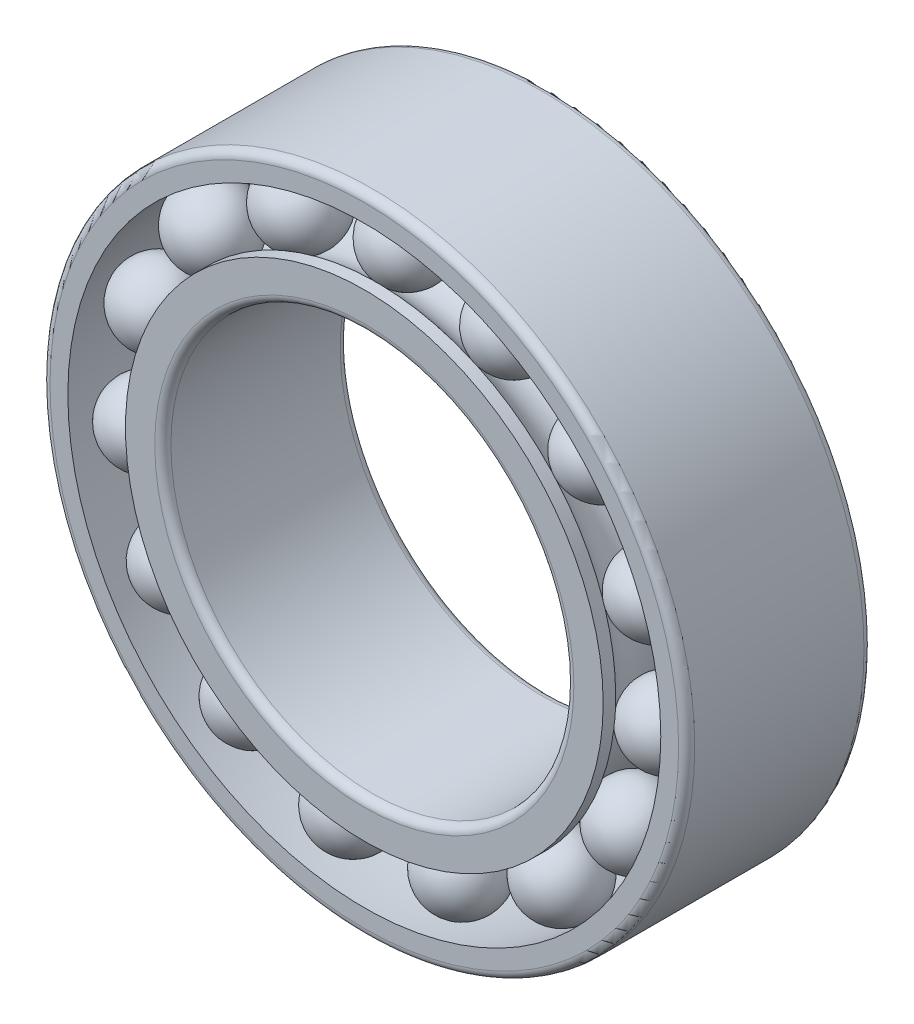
SolidWorks part; units mm, degrees
ref_plane "Front Plane" through (0, 0, 0) normal (0, 0, 1) x (1, 0, 0)
ref_plane "Top Plane" through (0, 0, 0) normal (0, 1, 0) x (1, 0, 0)
ref_plane "Right Plane" through (0, 0, 0) normal (1, 0, 0) x (0, 0, -1)
other "Configuration Table"
sketch "BaseSke" plane through (0, 0, 0) normal (1, 0, 0) x (0, 0, -1)
  line L0 (-47.2296, 0) -> (24.6132, 0) construction
  line L1 (-47.2296, 32.5) -> (24.6132, 32.5) construction
  line L2 (0, 129.5214) -> (0, -86.3012) construction
  line L3 (-6.1333, 37.2917) -> (-6.1333, 27.7083)
  line L4 (-11.5, 40) -> (11.5, 40) construction
  line L5 (-11.5, 25) -> (11.5, 25) construction
  line L6 (-11.5, 40) -> (-11.5, 25) construction
  line L7 (11.5, 40) -> (11.5, 25) construction
  line L8 (-10.925, 40) -> (-10.925, 25) construction
  arc A0 (-6.1333, 37.2917) -> (-6.1333, 27.7083) centre (-6.1333, 32.5) ccw
revolve "Ball" add sketch "BaseSke" angle 360 about L3
sketch "OuterRaceSke" plane through (0, 0, 0) normal (1, 0, 0) x (0, 0, -1)
  line L0 (0, 0) -> (0, 87.5396) construction
  line L1 (-11.5, 40) -> (11.5, 40)
  line L2 (-11.5, 40) -> (-11.5, 36.7859)
  line L4 (11.5, 40) -> (11.5, 36.7859)
  line L5 (-50.3916, 0) -> (55.2197, 0) construction
  arc A0 (-11.5, 36.7859) -> (11.5, 36.7859) centre (0, -62.5507) cw
  arc A1 (-11.5, 36.8262) -> (11.5, 36.8262) centre (0, -62.5507) cw construction
  arc A2 (-6.1333, 37.2917) -> (-6.1333, 27.7083) centre (-6.1333, 32.5) ccw construction
revolve "OuterRace" add sketch "OuterRaceSke" angle 360 about L5
mirror "MirrorBall" about plane through (0, 0, 0) normal (0, 0, 1) of "Ball"
sketch "InnerRaceSke" plane through (0, 0, 0) normal (1, 0, 0) x (0, 0, -1)
  line L0 (-70.8626, 0) -> (113.5527, 0) construction
  line L1 (0, 58.441) -> (0, -70.8113) construction
  line L2 (-11.5, 25) -> (11.5, 25)
  line L3 (-11.5, 25) -> (-11.5, 29.6379)
  line L4 (-11.5, 29.6379) -> (-9.9495, 29.6379)
  line L5 (11.5, 25) -> (11.5, 29.6379)
  line L6 (0, 129.5214) -> (0, -86.3012) construction
  line L7 (-2.3172, 29.6379) -> (2.3172, 29.6379)
  line L8 (11.5, 29.6379) -> (9.9495, 29.6379)
  line L9 (-47.2296, 32.5) -> (24.6132, 32.5) construction
  arc A0 (-9.9495, 29.6379) -> (-2.3172, 29.6379) centre (-6.1333, 32.5) ccw
  circle A1 centre (-6.1333, 32.5) radius 4.7917 construction
  arc A2 (9.9495, 29.6379) -> (2.3172, 29.6379) centre (6.1333, 32.5) cw
  point P17 (0, 25)
  point P23 (0, 29.6379)
revolve "InnerRace" add sketch "InnerRaceSke" angle 360 about L0
fillet "Fillet1" radius 1 4 edges at (25, 0, -11.5) (25, 0, 11.5) (40, 0, -11.5) (40, 0, 11.5)
pattern_circular "CirPatternBall" count 15 over 360 about axis through (0, 0, 0) along (0, 0, 1) of "Ball", "MirrorBall"
sketch "SimplifiedSke" plane through (0, 0, 0) normal (1, 0, 0) x (0, 0, -1)
  line L0 (37.5911, 0) -> (-37.5911, 0) construction
  line L1 (0, 0) -> (0, 72.9012) construction
  circle A0 centre (-6.1333, 32.5) radius 4.7917
  circle A1 centre (-6.1333, 32.5) radius 4.7917 construction
  circle A2 centre (6.1333, 32.5) radius 4.7917
revolve "Simplified" [suppressed] add sketch "SimplifiedSke" angle 360 about L0
equation "\"D1@BaseSke\" =  (\"Bearing_Outside_Diameter@BaseSke\"  +  \"Bearing_Inside_Diameter@BaseSke\"  )  / 4"
equation "\"Ball_diameter@BaseSke\" = \"Bearing_Thickness@BaseSke\" / 2.4"
equation "\"D2@BaseSke\" = \"Bearing_Thickness@BaseSke\"/40"
equation "\"D1@CirPatternBall\" = int( \"D1@BaseSke\"* pi  * 2 / \"Ball_diameter@BaseSke\" /1.4)"
equation "\"D2@InnerRaceSke\" = \"Ball_diameter@BaseSke\"-0.02-0.001*\"Bearing_Thickness@BaseSke\""
equation "\"D1@OuterRaceSke\" = \"Bearing_Inside_Diameter@BaseSke\"*2"
equation "\"D1@InnerRaceSke\" = \"D2@InnerRaceSke\" * 0.3"
